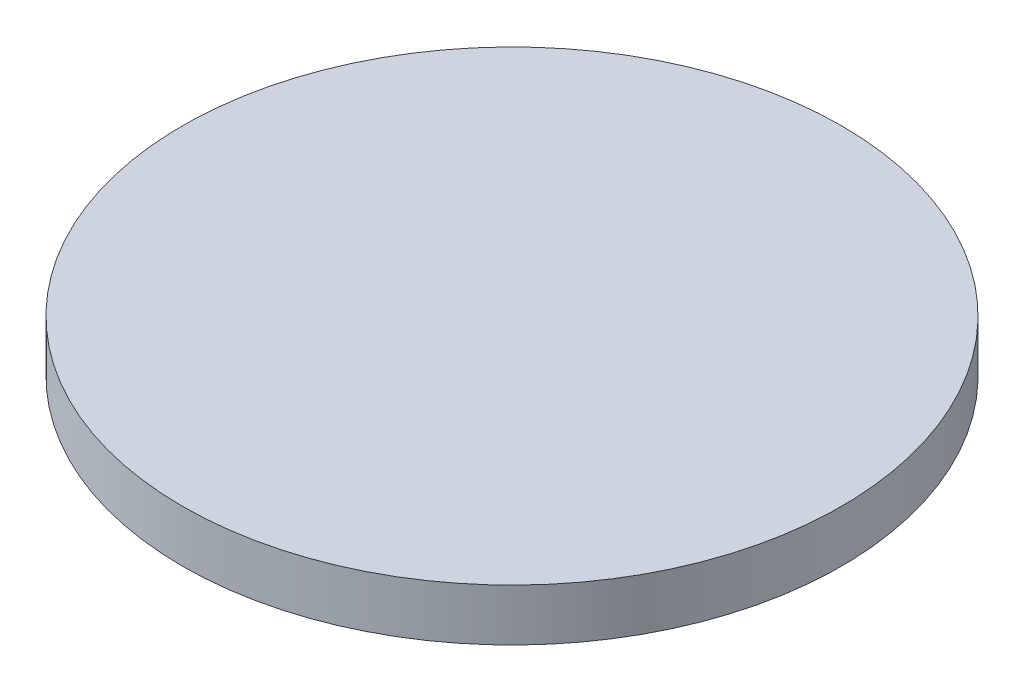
SolidWorks part; units mm, degrees
ref_plane "Front Plane" through (0, 0, 0) normal (0, 0, 1) x (1, 0, 0)
ref_plane "Top Plane" through (0, 0, 0) normal (0, 1, 0) x (1, 0, 0)
ref_plane "Right Plane" through (0, 0, 0) normal (1, 0, 0) x (0, 0, -1)
sketch "Sketch1" plane through (0, 0, 0) normal (0, 1, 0) x (1, 0, 0)
  circle A0 centre (0, 0) radius 12.7
  dimension "D1" = 25.4
extrude "Boss-Extrude1" add sketch "Sketch1" along normal blind 2
sketch "Sketch2" plane through (0, 2, 0) normal (0, 1, 0) x (1, 0, 0)
  circle A0 centre (0, 0) radius 1
  dimension "D1" = 2
extrude "Boss-Extrude2" [suppressed] add sketch "Sketch2" along normal blind 500
